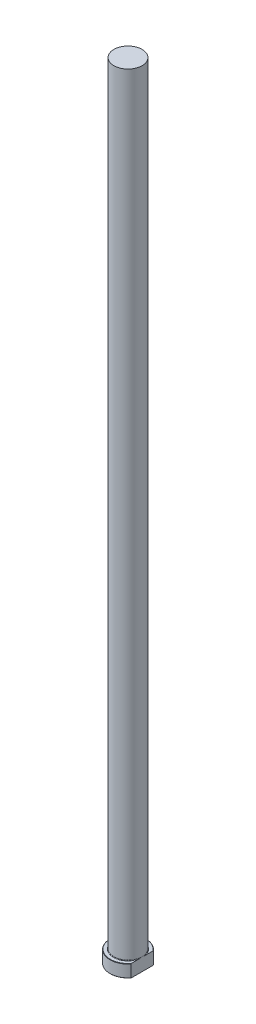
SolidWorks part; units mm, degrees
ref_plane "Front Plane" through (0, 0, 0) normal (0, 0, 1) x (1, 0, 0)
ref_plane "Top Plane" through (0, 0, 0) normal (0, 1, 0) x (1, 0, 0)
ref_plane "Right Plane" through (0, 0, 0) normal (1, 0, 0) x (0, 0, -1)
sketch "Sketch1" plane through (0, 0, 0) normal (0, 0, 1) x (1, 0, 0)
  line L0 (0, 259.9588) -> (0, -15.1925) construction
  line L1 (0, 0) -> (-11.5, 0)
  line L2 (-11.5, 0) -> (-11.5, 8)
  line L3 (-11.5, 8) -> (-9, 8)
  line L4 (-9, 8) -> (-9, 500)
  line L5 (-9, 500) -> (0, 500)
  line L6 (0, 500) -> (0, 0)
  dimension "L" = 500
  dimension "H" = 23
  dimension "T" = 8
  dimension "D" = 18
revolve "Revolve1" add sketch "Sketch1" angle 360 about L0
chamfer "Chamfer1" distance 0.2 angle 45 2 edges at (0, 8, 11.5) (0, 0, 11.5)
fillet "Fillet1" radius 0.3 1 edges at (0, 8, 9)
sketch "Sketch2" plane through (0, 0, 0) normal (0, 1, 0) x (1, 0, 0)
  line L0 (9, -7.1589) -> (9, 7.1589)
  circle A0 centre (0, 0) radius 11.5 construction
  arc A1 (9, -7.1589) -> (9, 7.1589) centre (0, 0) ccw
  circle A2 centre (0, 0) radius 9 construction
extrude "KEYED HEAD" cut sketch "Sketch2" along normal through all
